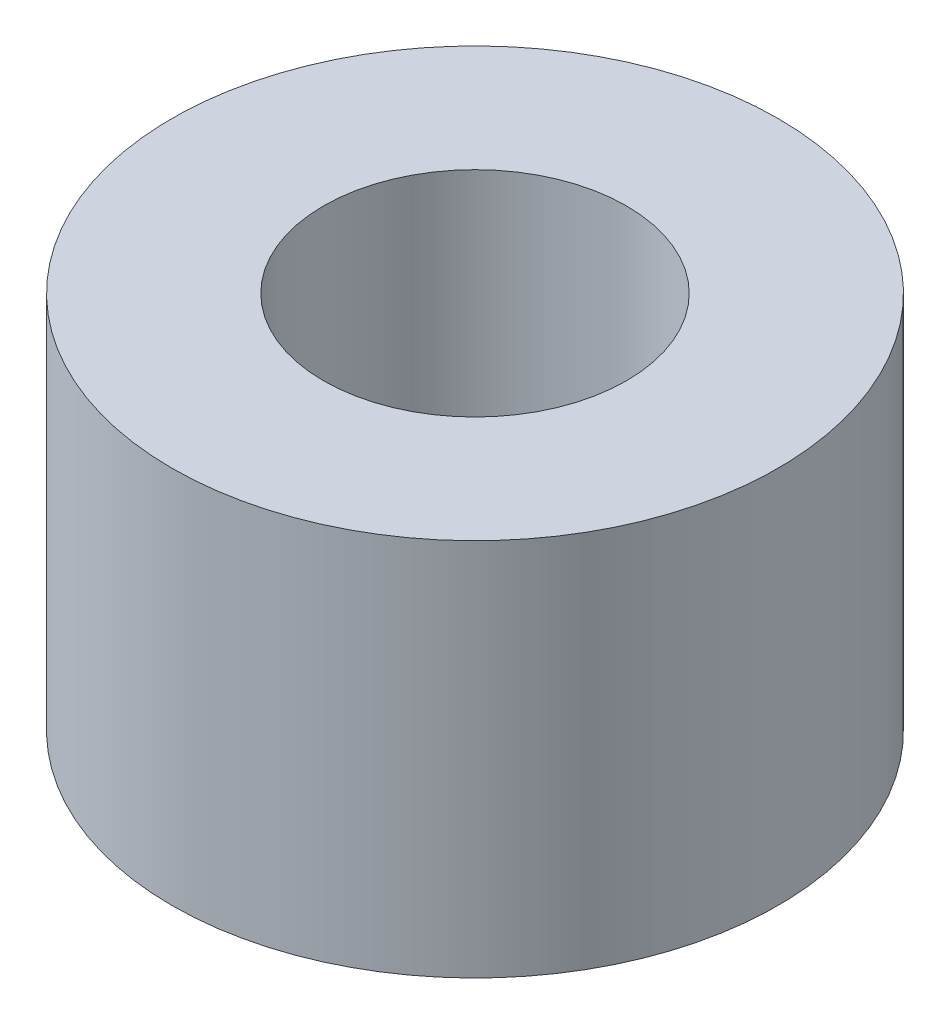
SolidWorks part; units mm, degrees
ref_plane "Front Plane" through (0, 0, 0) normal (0, 0, 1) x (1, 0, 0)
ref_plane "Top Plane" through (0, 0, 0) normal (0, 1, 0) x (1, 0, 0)
ref_plane "Right Plane" through (0, 0, 0) normal (1, 0, 0) x (0, 0, -1)
sketch "Sketch1" plane through (0, 0, 0) normal (0, 1, 0) x (1, 0, 0)
  circle A0 centre (0, 0) radius 1.27
  circle A1 centre (0, 0) radius 2.54
  dimension "D1" = 2.54
  dimension "D2" = 5.08
extrude "Boss-Extrude1" add sketch "Sketch1" along normal blind 3.175
